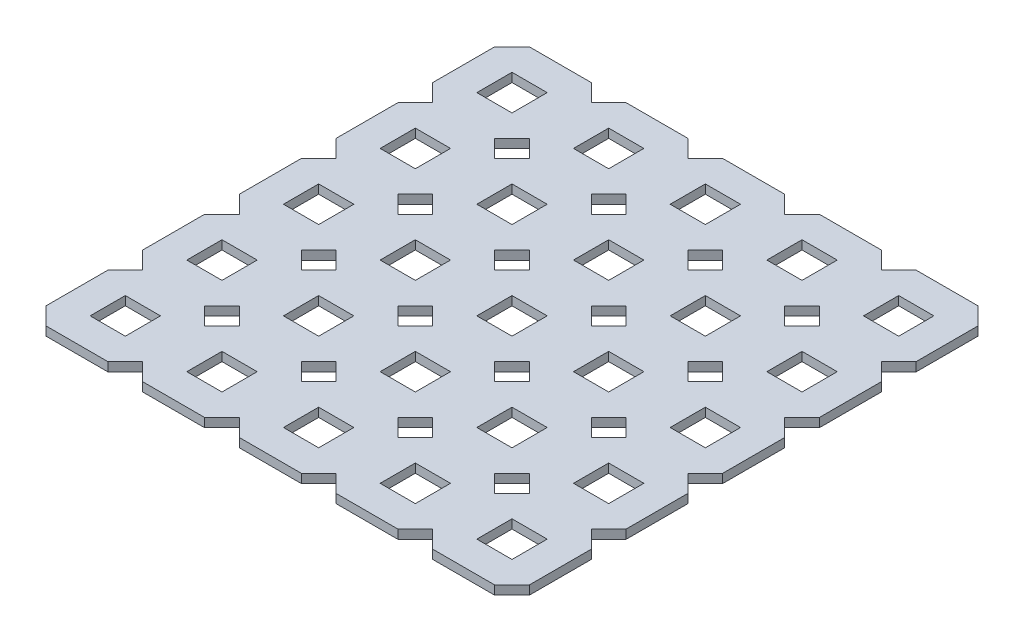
SolidWorks part; units mm, degrees
ref_plane "Front" through (0, 0, 0) normal (0, 0, 1) x (1, 0, 0)
ref_plane "Top" through (0, 0, 0) normal (0, 1, 0) x (1, 0, 0)
ref_plane "Right" through (0, 0, 0) normal (1, 0, 0) x (0, 0, -1)
ref_plane "Plane1" through (0, 1.1684, 0) normal (0, 1, 0) x (1, 0, 0)
sketch "Sketch1" plane through (0, 1.1684, 0) normal (0, 1, 0) x (1, 0, 0)
  line L0 (14.981, 127) -> (12.7, 124.719)
  line L1 (12.7, 124.719) -> (10.419, 127)
  line L2 (10.419, 127) -> (2.281, 127)
  line L3 (2.281, 127) -> (0, 124.719)
  line L4 (0, 124.719) -> (0, 116.581)
  line L5 (0, 116.581) -> (2.281, 114.3)
  line L6 (2.281, 114.3) -> (0, 112.019)
  line L7 (0, 112.019) -> (0, 103.881)
  line L8 (0, 103.881) -> (2.281, 101.6)
  line L9 (2.281, 101.6) -> (0, 99.319)
  line L10 (0, 99.319) -> (0, 91.181)
  line L11 (0, 91.181) -> (2.281, 88.9)
  line L12 (2.281, 88.9) -> (0, 86.619)
  line L13 (0, 86.619) -> (0, 78.481)
  line L14 (0, 78.481) -> (2.281, 76.2)
  line L15 (2.281, 76.2) -> (0, 73.919)
  line L16 (0, 73.919) -> (0, 65.781)
  line L17 (0, 65.781) -> (2.281, 63.5)
  line L18 (2.281, 63.5) -> (0, 61.219)
  line L19 (0, 61.219) -> (0, 53.081)
  line L20 (0, 53.081) -> (2.281, 50.8)
  line L21 (2.281, 50.8) -> (0, 48.519)
  line L22 (0, 48.519) -> (0, 40.381)
  line L23 (0, 40.381) -> (2.281, 38.1)
  line L24 (2.281, 38.1) -> (0, 35.819)
  line L25 (0, 35.819) -> (0, 27.681)
  line L26 (0, 27.681) -> (2.281, 25.4)
  line L27 (2.281, 25.4) -> (0, 23.119)
  line L28 (0, 23.119) -> (0, 14.981)
  line L29 (0, 14.981) -> (2.281, 12.7)
  line L30 (2.281, 12.7) -> (0, 10.419)
  line L31 (0, 10.419) -> (0, 2.281)
  line L32 (0, 2.281) -> (2.281, 0)
  line L33 (2.281, 0) -> (10.419, 0)
  line L34 (10.419, 0) -> (12.7, 2.281)
  line L35 (12.7, 2.281) -> (14.981, 0)
  line L36 (14.981, 0) -> (23.119, 0)
  line L37 (23.119, 0) -> (25.4, 2.281)
  line L38 (25.4, 2.281) -> (27.681, 0)
  line L39 (27.681, 0) -> (35.819, 0)
  line L40 (35.819, 0) -> (38.1, 2.281)
  line L41 (38.1, 2.281) -> (40.381, 0)
  line L42 (40.381, 0) -> (48.519, 0)
  line L43 (48.519, 0) -> (50.8, 2.281)
  line L44 (50.8, 2.281) -> (53.081, 0)
  line L45 (53.081, 0) -> (61.219, 0)
  line L46 (61.219, 0) -> (63.5, 2.281)
  line L47 (63.5, 2.281) -> (63.5, 10.419)
  line L48 (63.5, 10.419) -> (61.219, 12.7)
  line L49 (61.219, 12.7) -> (63.5, 14.981)
  line L50 (63.5, 14.981) -> (63.5, 23.119)
  line L51 (63.5, 23.119) -> (61.219, 25.4)
  line L52 (61.219, 25.4) -> (63.5, 27.681)
  line L53 (63.5, 27.681) -> (63.5, 35.819)
  line L54 (63.5, 35.819) -> (61.219, 38.1)
  line L55 (61.219, 38.1) -> (63.5, 40.381)
  line L56 (63.5, 40.381) -> (63.5, 48.519)
  line L57 (63.5, 48.519) -> (61.219, 50.8)
  line L58 (61.219, 50.8) -> (63.5, 53.081)
  line L59 (63.5, 53.081) -> (63.5, 61.219)
  line L60 (63.5, 61.219) -> (61.219, 63.5)
  line L61 (61.219, 63.5) -> (63.5, 65.781)
  line L62 (63.5, 65.781) -> (63.5, 73.919)
  line L63 (63.5, 73.919) -> (61.219, 76.2)
  line L64 (61.219, 76.2) -> (63.5, 78.481)
  line L65 (63.5, 78.481) -> (63.5, 86.619)
  line L66 (63.5, 86.619) -> (61.219, 88.9)
  line L67 (61.219, 88.9) -> (63.5, 91.181)
  line L68 (63.5, 91.181) -> (63.5, 99.319)
  line L69 (63.5, 99.319) -> (61.219, 101.6)
  line L70 (61.219, 101.6) -> (63.5, 103.881)
  line L71 (63.5, 103.881) -> (63.5, 112.019)
  line L72 (63.5, 112.019) -> (61.219, 114.3)
  line L73 (61.219, 114.3) -> (63.5, 116.581)
  line L74 (63.5, 116.581) -> (63.5, 124.719)
  line L75 (63.5, 124.719) -> (61.219, 127)
  line L76 (61.219, 127) -> (53.081, 127)
  line L77 (53.081, 127) -> (50.8, 124.719)
  line L78 (50.8, 124.719) -> (48.519, 127)
  line L79 (48.519, 127) -> (40.381, 127)
  line L80 (40.381, 127) -> (38.1, 124.719)
  line L81 (38.1, 124.719) -> (35.819, 127)
  line L82 (35.819, 127) -> (27.681, 127)
  line L83 (27.681, 127) -> (25.4, 124.719)
  line L84 (25.4, 124.719) -> (23.119, 127)
  line L85 (23.119, 127) -> (14.981, 127)
  line L86 (12.7, 112.019) -> (10.419, 114.3)
  line L87 (10.419, 114.3) -> (12.7, 116.581)
  line L88 (12.7, 116.581) -> (14.981, 114.3)
  line L89 (14.981, 114.3) -> (12.7, 112.019)
  line L90 (12.7, 86.619) -> (10.419, 88.9)
  line L91 (10.419, 88.9) -> (12.7, 91.181)
  line L92 (12.7, 91.181) -> (14.981, 88.9)
  line L93 (14.981, 88.9) -> (12.7, 86.619)
  line L94 (12.7, 61.219) -> (10.419, 63.5)
  line L95 (10.419, 63.5) -> (12.7, 65.781)
  line L96 (12.7, 65.781) -> (14.981, 63.5)
  line L97 (14.981, 63.5) -> (12.7, 61.219)
  line L98 (12.7, 35.819) -> (10.419, 38.1)
  line L99 (10.419, 38.1) -> (12.7, 40.381)
  line L100 (12.7, 40.381) -> (14.981, 38.1)
  line L101 (14.981, 38.1) -> (12.7, 35.819)
  line L102 (12.7, 10.419) -> (10.419, 12.7)
  line L103 (10.419, 12.7) -> (12.7, 14.981)
  line L104 (12.7, 14.981) -> (14.981, 12.7)
  line L105 (14.981, 12.7) -> (12.7, 10.419)
  line L106 (25.4, 112.019) -> (23.119, 114.3)
  line L107 (23.119, 114.3) -> (25.4, 116.581)
  line L108 (25.4, 116.581) -> (27.681, 114.3)
  line L109 (27.681, 114.3) -> (25.4, 112.019)
  line L110 (25.4, 86.619) -> (23.119, 88.9)
  line L111 (23.119, 88.9) -> (25.4, 91.181)
  line L112 (25.4, 91.181) -> (27.681, 88.9)
  line L113 (27.681, 88.9) -> (25.4, 86.619)
  line L114 (25.4, 61.219) -> (23.119, 63.5)
  line L115 (23.119, 63.5) -> (25.4, 65.781)
  line L116 (25.4, 65.781) -> (27.681, 63.5)
  line L117 (27.681, 63.5) -> (25.4, 61.219)
  line L118 (25.4, 35.819) -> (23.119, 38.1)
  line L119 (23.119, 38.1) -> (25.4, 40.381)
  line L120 (25.4, 40.381) -> (27.681, 38.1)
  line L121 (27.681, 38.1) -> (25.4, 35.819)
  line L122 (25.4, 10.419) -> (23.119, 12.7)
  line L123 (23.119, 12.7) -> (25.4, 14.981)
  line L124 (25.4, 14.981) -> (27.681, 12.7)
  line L125 (27.681, 12.7) -> (25.4, 10.419)
  line L126 (38.1, 112.019) -> (35.819, 114.3)
  line L127 (35.819, 114.3) -> (38.1, 116.581)
  line L128 (38.1, 116.581) -> (40.381, 114.3)
  line L129 (40.381, 114.3) -> (38.1, 112.019)
  line L130 (38.1, 86.619) -> (35.819, 88.9)
  line L131 (35.819, 88.9) -> (38.1, 91.181)
  line L132 (38.1, 91.181) -> (40.381, 88.9)
  line L133 (40.381, 88.9) -> (38.1, 86.619)
  line L134 (38.1, 61.219) -> (35.819, 63.5)
  line L135 (35.819, 63.5) -> (38.1, 65.781)
  line L136 (38.1, 65.781) -> (40.381, 63.5)
  line L137 (40.381, 63.5) -> (38.1, 61.219)
  line L138 (38.1, 35.819) -> (35.819, 38.1)
  line L139 (35.819, 38.1) -> (38.1, 40.381)
  line L140 (38.1, 40.381) -> (40.381, 38.1)
  line L141 (40.381, 38.1) -> (38.1, 35.819)
  line L142 (38.1, 10.419) -> (35.819, 12.7)
  line L143 (35.819, 12.7) -> (38.1, 14.981)
  line L144 (38.1, 14.981) -> (40.381, 12.7)
  line L145 (40.381, 12.7) -> (38.1, 10.419)
  line L146 (50.8, 112.019) -> (48.519, 114.3)
  line L147 (48.519, 114.3) -> (50.8, 116.581)
  line L148 (50.8, 116.581) -> (53.081, 114.3)
  line L149 (53.081, 114.3) -> (50.8, 112.019)
  line L150 (50.8, 86.619) -> (48.519, 88.9)
  line L151 (48.519, 88.9) -> (50.8, 91.181)
  line L152 (50.8, 91.181) -> (53.081, 88.9)
  line L153 (53.081, 88.9) -> (50.8, 86.619)
  line L154 (50.8, 61.219) -> (48.519, 63.5)
  line L155 (48.519, 63.5) -> (50.8, 65.781)
  line L156 (50.8, 65.781) -> (53.081, 63.5)
  line L157 (53.081, 63.5) -> (50.8, 61.219)
  line L158 (50.8, 35.819) -> (48.519, 38.1)
  line L159 (48.519, 38.1) -> (50.8, 40.381)
  line L160 (50.8, 40.381) -> (53.081, 38.1)
  line L161 (53.081, 38.1) -> (50.8, 35.819)
  line L162 (50.8, 10.419) -> (48.519, 12.7)
  line L163 (48.519, 12.7) -> (50.8, 14.981)
  line L164 (50.8, 14.981) -> (53.081, 12.7)
  line L165 (53.081, 12.7) -> (50.8, 10.419)
  line L166 (8.6614, 122.9614) -> (8.6614, 118.3386)
  line L167 (8.6614, 118.3386) -> (4.0386, 118.3386)
  line L168 (4.0386, 118.3386) -> (4.0386, 122.9614)
  line L169 (4.0386, 122.9614) -> (8.6614, 122.9614)
  line L170 (21.3614, 122.9614) -> (21.3614, 118.3386)
  line L171 (21.3614, 118.3386) -> (16.7386, 118.3386)
  line L172 (16.7386, 118.3386) -> (16.7386, 122.9614)
  line L173 (16.7386, 122.9614) -> (21.3614, 122.9614)
  line L174 (34.0614, 122.9614) -> (34.0614, 118.3386)
  line L175 (34.0614, 118.3386) -> (29.4386, 118.3386)
  line L176 (29.4386, 118.3386) -> (29.4386, 122.9614)
  line L177 (29.4386, 122.9614) -> (34.0614, 122.9614)
  line L178 (46.7614, 122.9614) -> (46.7614, 118.3386)
  line L179 (46.7614, 118.3386) -> (42.1386, 118.3386)
  line L180 (42.1386, 118.3386) -> (42.1386, 122.9614)
  line L181 (42.1386, 122.9614) -> (46.7614, 122.9614)
  line L182 (59.4614, 122.9614) -> (59.4614, 118.3386)
  line L183 (59.4614, 118.3386) -> (54.8386, 118.3386)
  line L184 (54.8386, 118.3386) -> (54.8386, 122.9614)
  line L185 (54.8386, 122.9614) -> (59.4614, 122.9614)
  line L186 (8.6614, 110.2614) -> (8.6614, 105.6386)
  line L187 (8.6614, 105.6386) -> (4.0386, 105.6386)
  line L188 (4.0386, 105.6386) -> (4.0386, 110.2614)
  line L189 (4.0386, 110.2614) -> (8.6614, 110.2614)
  line L190 (59.4614, 110.2614) -> (59.4614, 105.6386)
  line L191 (59.4614, 105.6386) -> (54.8386, 105.6386)
  line L192 (54.8386, 105.6386) -> (54.8386, 110.2614)
  line L193 (54.8386, 110.2614) -> (59.4614, 110.2614)
  line L194 (8.6614, 97.5614) -> (8.6614, 92.9386)
  line L195 (8.6614, 92.9386) -> (4.0386, 92.9386)
  line L196 (4.0386, 92.9386) -> (4.0386, 97.5614)
  line L197 (4.0386, 97.5614) -> (8.6614, 97.5614)
  line L198 (59.4614, 97.5614) -> (59.4614, 92.9386)
  line L199 (59.4614, 92.9386) -> (54.8386, 92.9386)
  line L200 (54.8386, 92.9386) -> (54.8386, 97.5614)
  line L201 (54.8386, 97.5614) -> (59.4614, 97.5614)
  line L202 (8.6614, 84.8614) -> (8.6614, 80.2386)
  line L203 (8.6614, 80.2386) -> (4.0386, 80.2386)
  line L204 (4.0386, 80.2386) -> (4.0386, 84.8614)
  line L205 (4.0386, 84.8614) -> (8.6614, 84.8614)
  line L206 (59.4614, 84.8614) -> (59.4614, 80.2386)
  line L207 (59.4614, 80.2386) -> (54.8386, 80.2386)
  line L208 (54.8386, 80.2386) -> (54.8386, 84.8614)
  line L209 (54.8386, 84.8614) -> (59.4614, 84.8614)
  line L210 (8.6614, 72.1614) -> (8.6614, 67.5386)
  line L211 (8.6614, 67.5386) -> (4.0386, 67.5386)
  line L212 (4.0386, 67.5386) -> (4.0386, 72.1614)
  line L213 (4.0386, 72.1614) -> (8.6614, 72.1614)
  line L214 (59.4614, 72.1614) -> (59.4614, 67.5386)
  line L215 (59.4614, 67.5386) -> (54.8386, 67.5386)
  line L216 (54.8386, 67.5386) -> (54.8386, 72.1614)
  line L217 (54.8386, 72.1614) -> (59.4614, 72.1614)
  line L218 (8.6614, 59.4614) -> (8.6614, 54.8386)
  line L219 (8.6614, 54.8386) -> (4.0386, 54.8386)
  line L220 (4.0386, 54.8386) -> (4.0386, 59.4614)
  line L221 (4.0386, 59.4614) -> (8.6614, 59.4614)
  line L222 (59.4614, 59.4614) -> (59.4614, 54.8386)
  line L223 (59.4614, 54.8386) -> (54.8386, 54.8386)
  line L224 (54.8386, 54.8386) -> (54.8386, 59.4614)
  line L225 (54.8386, 59.4614) -> (59.4614, 59.4614)
  line L226 (8.6614, 46.7614) -> (8.6614, 42.1386)
  line L227 (8.6614, 42.1386) -> (4.0386, 42.1386)
  line L228 (4.0386, 42.1386) -> (4.0386, 46.7614)
  line L229 (4.0386, 46.7614) -> (8.6614, 46.7614)
  line L230 (59.4614, 46.7614) -> (59.4614, 42.1386)
  line L231 (59.4614, 42.1386) -> (54.8386, 42.1386)
  line L232 (54.8386, 42.1386) -> (54.8386, 46.7614)
  line L233 (54.8386, 46.7614) -> (59.4614, 46.7614)
  line L234 (8.6614, 34.0614) -> (8.6614, 29.4386)
  line L235 (8.6614, 29.4386) -> (4.0386, 29.4386)
  line L236 (4.0386, 29.4386) -> (4.0386, 34.0614)
  line L237 (4.0386, 34.0614) -> (8.6614, 34.0614)
  line L238 (59.4614, 34.0614) -> (59.4614, 29.4386)
  line L239 (59.4614, 29.4386) -> (54.8386, 29.4386)
  line L240 (54.8386, 29.4386) -> (54.8386, 34.0614)
  line L241 (54.8386, 34.0614) -> (59.4614, 34.0614)
  line L242 (8.6614, 21.3614) -> (8.6614, 16.7386)
  line L243 (8.6614, 16.7386) -> (4.0386, 16.7386)
  line L244 (4.0386, 16.7386) -> (4.0386, 21.3614)
  line L245 (4.0386, 21.3614) -> (8.6614, 21.3614)
  line L246 (59.4614, 21.3614) -> (59.4614, 16.7386)
  line L247 (59.4614, 16.7386) -> (54.8386, 16.7386)
  line L248 (54.8386, 16.7386) -> (54.8386, 21.3614)
  line L249 (54.8386, 21.3614) -> (59.4614, 21.3614)
  line L250 (8.6614, 8.6614) -> (8.6614, 4.0386)
  line L251 (8.6614, 4.0386) -> (4.0386, 4.0386)
  line L252 (4.0386, 4.0386) -> (4.0386, 8.6614)
  line L253 (4.0386, 8.6614) -> (8.6614, 8.6614)
  line L254 (21.3614, 8.6614) -> (21.3614, 4.0386)
  line L255 (21.3614, 4.0386) -> (16.7386, 4.0386)
  line L256 (16.7386, 4.0386) -> (16.7386, 8.6614)
  line L257 (16.7386, 8.6614) -> (21.3614, 8.6614)
  line L258 (34.0614, 8.6614) -> (34.0614, 4.0386)
  line L259 (34.0614, 4.0386) -> (29.4386, 4.0386)
  line L260 (29.4386, 4.0386) -> (29.4386, 8.6614)
  line L261 (29.4386, 8.6614) -> (34.0614, 8.6614)
  line L262 (21.3614, 110.2614) -> (21.3614, 105.6386)
  line L263 (21.3614, 105.6386) -> (16.7386, 105.6386)
  line L264 (16.7386, 105.6386) -> (16.7386, 110.2614)
  line L265 (16.7386, 110.2614) -> (21.3614, 110.2614)
  line L266 (34.0614, 110.2614) -> (34.0614, 105.6386)
  line L267 (34.0614, 105.6386) -> (29.4386, 105.6386)
  line L268 (29.4386, 105.6386) -> (29.4386, 110.2614)
  line L269 (29.4386, 110.2614) -> (34.0614, 110.2614)
  line L270 (46.7614, 110.2614) -> (46.7614, 105.6386)
  line L271 (46.7614, 105.6386) -> (42.1386, 105.6386)
  line L272 (42.1386, 105.6386) -> (42.1386, 110.2614)
  line L273 (42.1386, 110.2614) -> (46.7614, 110.2614)
  line L274 (21.3614, 97.5614) -> (21.3614, 92.9386)
  line L275 (21.3614, 92.9386) -> (16.7386, 92.9386)
  line L276 (16.7386, 92.9386) -> (16.7386, 97.5614)
  line L277 (16.7386, 97.5614) -> (21.3614, 97.5614)
  line L278 (34.0614, 97.5614) -> (34.0614, 92.9386)
  line L279 (34.0614, 92.9386) -> (29.4386, 92.9386)
  line L280 (29.4386, 92.9386) -> (29.4386, 97.5614)
  line L281 (29.4386, 97.5614) -> (34.0614, 97.5614)
  line L282 (46.7614, 97.5614) -> (46.7614, 92.9386)
  line L283 (46.7614, 92.9386) -> (42.1386, 92.9386)
  line L284 (42.1386, 92.9386) -> (42.1386, 97.5614)
  line L285 (42.1386, 97.5614) -> (46.7614, 97.5614)
  line L286 (21.3614, 84.8614) -> (21.3614, 80.2386)
  line L287 (21.3614, 80.2386) -> (16.7386, 80.2386)
  line L288 (16.7386, 80.2386) -> (16.7386, 84.8614)
  line L289 (16.7386, 84.8614) -> (21.3614, 84.8614)
  line L290 (34.0614, 84.8614) -> (34.0614, 80.2386)
  line L291 (34.0614, 80.2386) -> (29.4386, 80.2386)
  line L292 (29.4386, 80.2386) -> (29.4386, 84.8614)
  line L293 (29.4386, 84.8614) -> (34.0614, 84.8614)
  line L294 (46.7614, 84.8614) -> (46.7614, 80.2386)
  line L295 (46.7614, 80.2386) -> (42.1386, 80.2386)
  line L296 (42.1386, 80.2386) -> (42.1386, 84.8614)
  line L297 (42.1386, 84.8614) -> (46.7614, 84.8614)
  line L298 (21.3614, 72.1614) -> (21.3614, 67.5386)
  line L299 (21.3614, 67.5386) -> (16.7386, 67.5386)
  line L300 (16.7386, 67.5386) -> (16.7386, 72.1614)
  line L301 (16.7386, 72.1614) -> (21.3614, 72.1614)
  line L302 (34.0614, 72.1614) -> (34.0614, 67.5386)
  line L303 (34.0614, 67.5386) -> (29.4386, 67.5386)
  line L304 (29.4386, 67.5386) -> (29.4386, 72.1614)
  line L305 (29.4386, 72.1614) -> (34.0614, 72.1614)
  line L306 (46.7614, 72.1614) -> (46.7614, 67.5386)
  line L307 (46.7614, 67.5386) -> (42.1386, 67.5386)
  line L308 (42.1386, 67.5386) -> (42.1386, 72.1614)
  line L309 (42.1386, 72.1614) -> (46.7614, 72.1614)
  line L310 (21.3614, 59.4614) -> (21.3614, 54.8386)
  line L311 (21.3614, 54.8386) -> (16.7386, 54.8386)
  line L312 (16.7386, 54.8386) -> (16.7386, 59.4614)
  line L313 (16.7386, 59.4614) -> (21.3614, 59.4614)
  line L314 (34.0614, 59.4614) -> (34.0614, 54.8386)
  line L315 (34.0614, 54.8386) -> (29.4386, 54.8386)
  line L316 (29.4386, 54.8386) -> (29.4386, 59.4614)
  line L317 (29.4386, 59.4614) -> (34.0614, 59.4614)
  line L318 (46.7614, 59.4614) -> (46.7614, 54.8386)
  line L319 (46.7614, 54.8386) -> (42.1386, 54.8386)
  line L320 (42.1386, 54.8386) -> (42.1386, 59.4614)
  line L321 (42.1386, 59.4614) -> (46.7614, 59.4614)
  line L322 (21.3614, 46.7614) -> (21.3614, 42.1386)
  line L323 (21.3614, 42.1386) -> (16.7386, 42.1386)
  line L324 (16.7386, 42.1386) -> (16.7386, 46.7614)
  line L325 (16.7386, 46.7614) -> (21.3614, 46.7614)
  line L326 (34.0614, 46.7614) -> (34.0614, 42.1386)
  line L327 (34.0614, 42.1386) -> (29.4386, 42.1386)
  line L328 (29.4386, 42.1386) -> (29.4386, 46.7614)
  line L329 (29.4386, 46.7614) -> (34.0614, 46.7614)
  line L330 (46.7614, 46.7614) -> (46.7614, 42.1386)
  line L331 (46.7614, 42.1386) -> (42.1386, 42.1386)
  line L332 (42.1386, 42.1386) -> (42.1386, 46.7614)
  line L333 (42.1386, 46.7614) -> (46.7614, 46.7614)
  line L334 (21.3614, 34.0614) -> (21.3614, 29.4386)
  line L335 (21.3614, 29.4386) -> (16.7386, 29.4386)
  line L336 (16.7386, 29.4386) -> (16.7386, 34.0614)
  line L337 (16.7386, 34.0614) -> (21.3614, 34.0614)
  line L338 (34.0614, 34.0614) -> (34.0614, 29.4386)
  line L339 (34.0614, 29.4386) -> (29.4386, 29.4386)
  line L340 (29.4386, 29.4386) -> (29.4386, 34.0614)
  line L341 (29.4386, 34.0614) -> (34.0614, 34.0614)
  line L342 (46.7614, 34.0614) -> (46.7614, 29.4386)
  line L343 (46.7614, 29.4386) -> (42.1386, 29.4386)
  line L344 (42.1386, 29.4386) -> (42.1386, 34.0614)
  line L345 (42.1386, 34.0614) -> (46.7614, 34.0614)
  line L346 (21.3614, 21.3614) -> (21.3614, 16.7386)
  line L347 (21.3614, 16.7386) -> (16.7386, 16.7386)
  line L348 (16.7386, 16.7386) -> (16.7386, 21.3614)
  line L349 (16.7386, 21.3614) -> (21.3614, 21.3614)
  line L350 (34.0614, 21.3614) -> (34.0614, 16.7386)
  line L351 (34.0614, 16.7386) -> (29.4386, 16.7386)
  line L352 (29.4386, 16.7386) -> (29.4386, 21.3614)
  line L353 (29.4386, 21.3614) -> (34.0614, 21.3614)
  line L354 (59.4614, 8.6614) -> (59.4614, 4.0386)
  line L355 (59.4614, 4.0386) -> (54.8386, 4.0386)
  line L356 (54.8386, 4.0386) -> (54.8386, 8.6614)
  line L357 (54.8386, 8.6614) -> (59.4614, 8.6614)
  line L358 (46.7614, 21.3614) -> (46.7614, 16.7386)
  line L359 (46.7614, 16.7386) -> (42.1386, 16.7386)
  line L360 (42.1386, 16.7386) -> (42.1386, 21.3614)
  line L361 (42.1386, 21.3614) -> (46.7614, 21.3614)
  line L362 (46.7614, 8.6614) -> (46.7614, 4.0386)
  line L363 (46.7614, 4.0386) -> (42.1386, 4.0386)
  line L364 (42.1386, 4.0386) -> (42.1386, 8.6614)
  line L365 (42.1386, 8.6614) -> (46.7614, 8.6614)
  line L366 (50.8, 23.119) -> (48.519, 25.4)
  line L367 (48.519, 25.4) -> (50.8, 27.681)
  line L368 (50.8, 27.681) -> (53.081, 25.4)
  line L369 (53.081, 25.4) -> (50.8, 23.119)
  line L370 (50.8, 48.519) -> (48.519, 50.8)
  line L371 (48.519, 50.8) -> (50.8, 53.081)
  line L372 (50.8, 53.081) -> (53.081, 50.8)
  line L373 (53.081, 50.8) -> (50.8, 48.519)
  line L374 (50.8, 73.919) -> (48.519, 76.2)
  line L375 (48.519, 76.2) -> (50.8, 78.481)
  line L376 (50.8, 78.481) -> (53.081, 76.2)
  line L377 (53.081, 76.2) -> (50.8, 73.919)
  line L378 (50.8, 99.319) -> (48.519, 101.6)
  line L379 (48.519, 101.6) -> (50.8, 103.881)
  line L380 (50.8, 103.881) -> (53.081, 101.6)
  line L381 (53.081, 101.6) -> (50.8, 99.319)
  line L382 (38.1, 23.119) -> (35.819, 25.4)
  line L383 (35.819, 25.4) -> (38.1, 27.681)
  line L384 (38.1, 27.681) -> (40.381, 25.4)
  line L385 (40.381, 25.4) -> (38.1, 23.119)
  line L386 (38.1, 48.519) -> (35.819, 50.8)
  line L387 (35.819, 50.8) -> (38.1, 53.081)
  line L388 (38.1, 53.081) -> (40.381, 50.8)
  line L389 (40.381, 50.8) -> (38.1, 48.519)
  line L390 (38.1, 73.919) -> (35.819, 76.2)
  line L391 (35.819, 76.2) -> (38.1, 78.481)
  line L392 (38.1, 78.481) -> (40.381, 76.2)
  line L393 (40.381, 76.2) -> (38.1, 73.919)
  line L394 (38.1, 99.319) -> (35.819, 101.6)
  line L395 (35.819, 101.6) -> (38.1, 103.881)
  line L396 (38.1, 103.881) -> (40.381, 101.6)
  line L397 (40.381, 101.6) -> (38.1, 99.319)
  line L398 (25.4, 23.119) -> (23.119, 25.4)
  line L399 (23.119, 25.4) -> (25.4, 27.681)
  line L400 (25.4, 27.681) -> (27.681, 25.4)
  line L401 (27.681, 25.4) -> (25.4, 23.119)
  line L402 (25.4, 48.519) -> (23.119, 50.8)
  line L403 (23.119, 50.8) -> (25.4, 53.081)
  line L404 (25.4, 53.081) -> (27.681, 50.8)
  line L405 (27.681, 50.8) -> (25.4, 48.519)
  line L406 (25.4, 73.919) -> (23.119, 76.2)
  line L407 (23.119, 76.2) -> (25.4, 78.481)
  line L408 (25.4, 78.481) -> (27.681, 76.2)
  line L409 (27.681, 76.2) -> (25.4, 73.919)
  line L410 (25.4, 99.319) -> (23.119, 101.6)
  line L411 (23.119, 101.6) -> (25.4, 103.881)
  line L412 (25.4, 103.881) -> (27.681, 101.6)
  line L413 (27.681, 101.6) -> (25.4, 99.319)
  line L414 (12.7, 23.119) -> (10.419, 25.4)
  line L415 (10.419, 25.4) -> (12.7, 27.681)
  line L416 (12.7, 27.681) -> (14.981, 25.4)
  line L417 (14.981, 25.4) -> (12.7, 23.119)
  line L418 (12.7, 48.519) -> (10.419, 50.8)
  line L419 (10.419, 50.8) -> (12.7, 53.081)
  line L420 (12.7, 53.081) -> (14.981, 50.8)
  line L421 (14.981, 50.8) -> (12.7, 48.519)
  line L422 (12.7, 73.919) -> (10.419, 76.2)
  line L423 (10.419, 76.2) -> (12.7, 78.481)
  line L424 (12.7, 78.481) -> (14.981, 76.2)
  line L425 (14.981, 76.2) -> (12.7, 73.919)
  line L426 (12.7, 99.319) -> (10.419, 101.6)
  line L427 (10.419, 101.6) -> (12.7, 103.881)
  line L428 (12.7, 103.881) -> (14.981, 101.6)
  line L429 (14.981, 101.6) -> (12.7, 99.319)
extrude "Boss-Extrude1" add sketch "Sketch1" against normal blind 1.1684
sketch "Sketch2" plane through (0, 1.1684, 0) normal (0, 1, 0) x (1, 0, 0)
  line L1 (63.5, 127) -> (0, 127)
  line L2 (63.5, 127) -> (63.5, 63.5)
  line L3 (63.5, 63.5) -> (0, 63.5)
  line L4 (0, 127) -> (0, 63.5)
extrude "Cut-Extrude1" cut sketch "Sketch2" against normal blind 2.54
